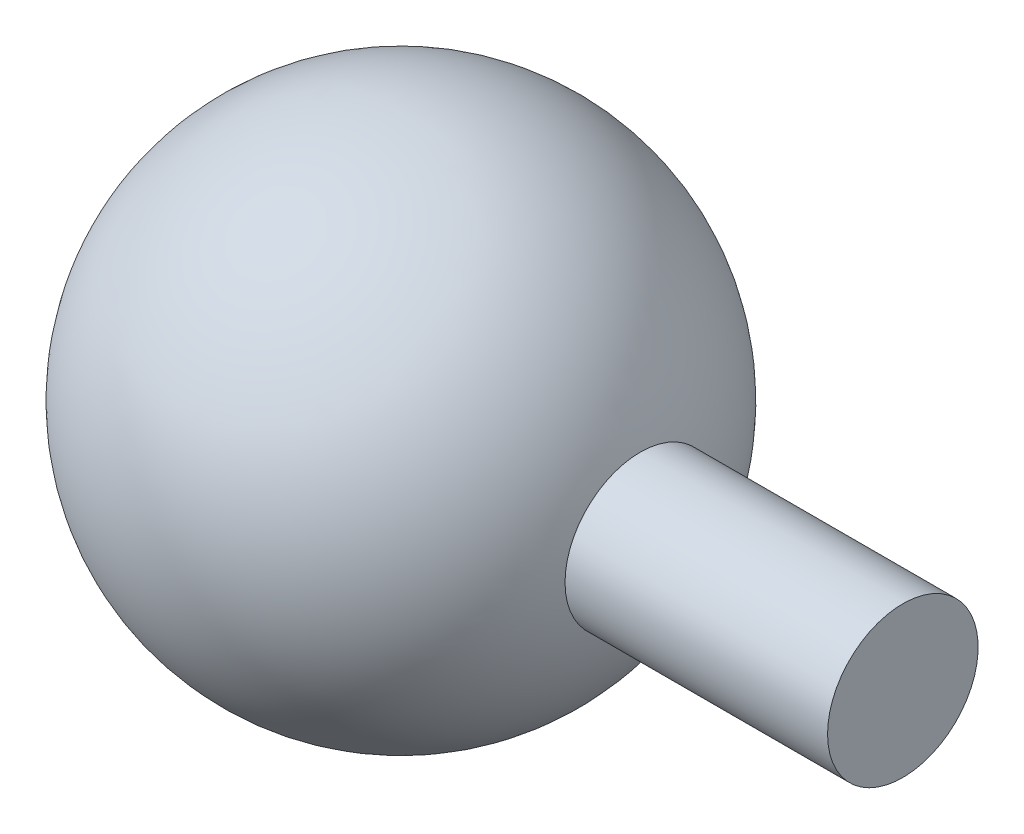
SolidWorks part; units mm, degrees
ref_plane "Ebene vorne" through (0, 0, 0) normal (0, 0, 1) x (1, 0, 0)
ref_plane "Ebene oben" through (0, 0, 0) normal (0, 1, 0) x (1, 0, 0)
ref_plane "Ebene rechts" through (0, 0, 0) normal (1, 0, 0) x (0, 0, -1)
sketch "Skizze1" plane through (0, 0, 0) normal (0, 0, 1) x (1, 0, 0)
  line L0 (0, 0) -> (111.5874, 0) construction
  line L1 (47.697, 15) -> (100, 15)
  line L2 (100, 15) -> (100, 0)
  line L4 (100, 0) -> (-50, 0)
  arc A0 (47.697, 15) -> (-50, 0) centre (0, 0) ccw
  dimension "D1" = 100
  dimension "D2" = 30
  dimension "D3" = 100
revolve "Rotation1" add sketch "Skizze1" angle 360 about L0
